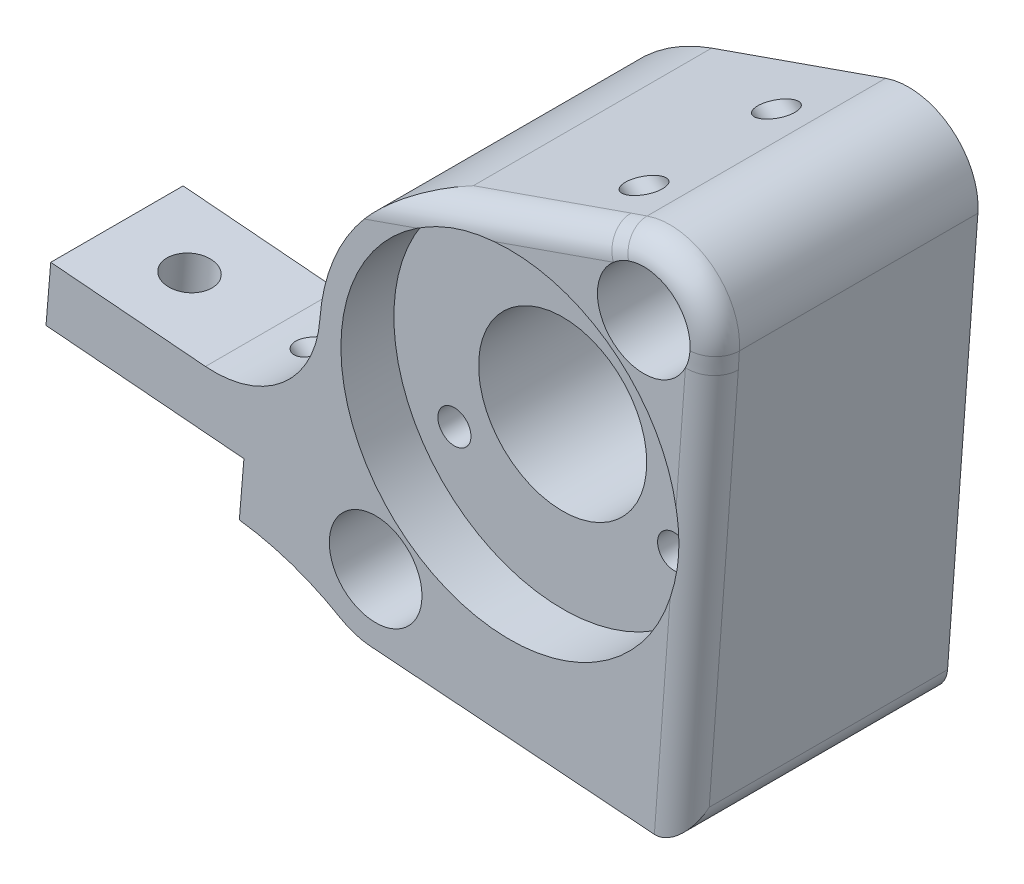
SolidWorks part; units mm, degrees
ref_plane "Front Plane" through (0, 0, 0) normal (0, 0, 1) x (1, 0, 0)
ref_plane "Top Plane" through (0, 0, 0) normal (0, 1, 0) x (1, 0, 0)
ref_plane "Right Plane" through (0, 0, 0) normal (1, 0, 0) x (0, 0, -1)
imported_body "Imported3"
sketch "Sketch1" plane through (0, 0, 18.867) normal (0, 0, 1) x (1, 0, 0)
  line L0 (-13.4246, -10.6666) -> (-13.0674, -6.3583)
  line L1 (-4.428, 1.0246) -> (-3.7297, 10.4722)
  line L2 (-3.7297, 10.4722) -> (18.3046, 18.1781)
  line L3 (25.2734, 12.8354) -> (22.8345, -20.1608)
  line L4 (22.8345, -20.1608) -> (-10.7231, -17.6803)
  line L5 (-10.7231, -17.6803) -> (-10.1639, -10.937)
  line L6 (-10.1639, -10.937) -> (-13.4246, -10.6666)
  arc A0 (-13.0674, -6.3583) -> (-4.428, 1.0246) centre (-12.4063, 1.6143) ccw
  arc A1 (18.3046, 18.1781) -> (25.2734, 12.8354) centre (20.0377, 13.2224) cw
extrude "Boss-Extrude1" add sketch "Sketch1" along normal blind 1.133
sketch "Sketch2" plane through (-12.4545, 1.0328, 0) normal (-0.9966, 0.0826, 0) x (0, 0, 1)
  line L0 (10, -11.6827) -> (10, -7.4165)
  line L1 (10, -7.4165) -> (20, -7.4165)
  line L2 (20, -7.4165) -> (20, -11.7395)
  line L3 (20, -11.7395) -> (18.867, -11.7395)
  line L4 (18.867, -11.7395) -> (18.2791, -10.4597)
  line L5 (18.2791, -10.4597) -> (16.8262, -10.4515)
  line L6 (16.8262, -10.4515) -> (16.3354, -11.4887)
  line L7 (15.9444, -11.7165) -> (13.7842, -11.7042)
  line L8 (13.7842, -11.7042) -> (13.1992, -10.4308)
  line L9 (13.1992, -10.4308) -> (11.7463, -10.4226)
  line L10 (11.7463, -10.4226) -> (11.2555, -11.4598)
  line L11 (10.8645, -11.6876) -> (10, -11.6827)
  arc A0 (16.3354, -11.4887) -> (15.9444, -11.7165) centre (15.9862, -11.3388) cw
  arc A1 (11.2555, -11.4598) -> (10.8645, -11.6876) centre (10.9063, -11.3099) cw
extrude "Boss-Extrude2" add sketch "Sketch2" along normal blind 11.728
sketch "Sketch3" plane through (0, 0, 10) normal (0, 0, -1) x (-1, 0, 0)
  line L0 (9.7488, -5.9314) -> (10.7231, -17.6803)
  line L1 (10.7231, -17.6803) -> (-22.8345, -20.1608)
  line L2 (-22.8345, -20.1608) -> (-25.2734, 12.8354)
  line L3 (-18.3046, 18.1781) -> (3.7297, 10.4722)
  line L4 (3.7297, 10.4722) -> (4.428, 1.0246)
  arc A0 (4.428, 1.0246) -> (9.7488, -5.9314) centre (12.4063, 1.6143) ccw
  arc A1 (-25.2734, 12.8354) -> (-18.3046, 18.1781) centre (-20.0377, 13.2224) cw
extrude "Boss-Extrude3" add sketch "Sketch3" along normal blind 10
sketch "Sketch4" plane through (0, 0, 0) normal (0, 0, -1) x (-1, 0, 0)
  line L0 (1.8992, -18.3326) -> (10.7231, -17.6803)
  line L1 (10.7231, -17.6803) -> (10.5106, -15.1178)
  arc A0 (10.5106, -15.1178) -> (1.8992, -18.3326) centre (13.0125, -34.9607) ccw
extrude "Cut-Extrude1" cut sketch "Sketch4" against normal through all
draft "Draft1" type of draft neutral plane draft angle 0.326 faces to draft 1 parameters "D1"=0.326
ref_plane "Plane1" through (3.6422, -2.7923, 0) normal (0.7936, -0.6084, 0) x (0, 0, -1)
hole_wizard "#2 Clearance Hole1" positions "Sketch6" profile "Sketch5" hole size "#2" standard "ANSI Inch"
sketch "Sketch6" plane through (3.6422, -2.7923, 0) normal (0.7936, -0.6084, 0) x (0, 0, -1)
  point P0 (-5, -10.6051)
sketch "Sketch5" plane through (-2.8102, -11.2086, 5) normal (0, 0, 1) x (0.6084, 0.7936, 0)
  line L0 (0, 0) -> (0, 35.7581)
  line L1 (0, 35.7581) -> (1.25, 35.7581)
  line L2 (1.25, 35.7581) -> (1.25, 0)
  line L5 (1.25, 0) -> (0, 0)
  line L11 (0, -6.35) -> (0, 107.95) construction
  dimension "Thru Hole Dia." = 2.5
  dimension "Thru Hole Depth" = 35.7581
ref_plane "Plane2" through (-4.0498, 3.1048, 0) normal (-0.7936, 0.6084, 0) x (0, 0, 1)
hole_wizard "#2 Clearance Hole2" positions "Sketch8" profile "Sketch7" hole size "#2" standard "ANSI Inch"
sketch "Sketch8" plane through (-4.0498, 3.1048, 0) normal (-0.7936, 0.6084, 0) x (0, 0, 1)
  point P0 (15, -10.6051)
sketch "Sketch7" plane through (-10.5022, -5.3115, 15) normal (0, 0, 1) x (-0.6084, -0.7936, 0)
  line L0 (0, 0) -> (0, 22.5281)
  line L1 (0, 22.5281) -> (1.25, 22.5281)
  line L2 (1.25, 22.5281) -> (1.25, 0)
  line L5 (1.25, 0) -> (0, 0)
  line L11 (0, -6.35) -> (0, 107.95) construction
  dimension "Thru Hole Dia." = 2.5
  dimension "Thru Hole Depth" = 22.5281
hole_wizard "1/4 Clearance Hole1" positions "Sketch10" profile "Sketch9" hole size "1/4" standard "ANSI Inch"
sketch "Sketch10" plane through (0, 0, 20) normal (0, 0, 1) x (1, 0, 0)
  point P0 (20.0377, 13.2224)
  point P1 (-0.2147, -13.1942)
sketch "Sketch9" plane through (20.0377, 13.2224, 20) normal (1, 0, 0) x (0, -1, 0)
  line L0 (0, 0) -> (0, 20)
  line L1 (0, 20) -> (3.5, 20)
  line L2 (3.5, 20) -> (3.5, 0)
  line L5 (3.5, 0) -> (0, 0)
  line L11 (0, -6.35) -> (0, 107.95) construction
  dimension "Thru Hole Dia." = 7
  dimension "Thru Hole Depth" = 20
ref_plane "Plane3" through (0.6033, -0.4625, 0) normal (-0.7936, 0.6084, 0) x (0, 0, 1)
hole_wizard "#2 Clearance Hole3" positions "Sketch12" profile "Sketch11" hole size "#2" standard "ANSI Inch"
sketch "Sketch12" plane through (0.6033, -0.4625, 0) normal (-0.7936, 0.6084, 0) x (0, 0, 1)
  point P0 (15, 22.6849)
  point P1 (5, 22.6849)
sketch "Sketch11" plane through (14.4054, 17.5405, 15) normal (0, 0, 1) x (-0.6084, -0.7936, 0)
  line L0 (0, 0) -> (0, 3.5971)
  line L1 (0, 3.5971) -> (1.25, 3.5971)
  line L2 (1.25, 3.5971) -> (1.25, 0)
  line L5 (1.25, 0) -> (0, 0)
  line L11 (0, -6.35) -> (0, 107.95) construction
  dimension "Thru Hole Dia." = 2.5
  dimension "Thru Hole Depth" = 3.5971
hole_wizard "Hole1" positions "Sketch14" profile "Sketch13" legacy
sketch "Sketch14" plane through (0, 0, 20) normal (0, 0, 1) x (1, 0, 0)
  point P0 (9.9115, 0.0141)
sketch "Sketch13" plane through (9.9115, 0.0141, 20) normal (1, 0, 0) x (0, -1, 0)
  line L0 (0, 0) -> (0, 20)
  line L1 (0, 20) -> (6.35, 20)
  line L2 (6.35, 20) -> (6.35, 4)
  line L3 (6.35, 4) -> (12.75, 4)
  line L4 (12.75, 4) -> (12.75, 0)
  line L5 (12.75, 0) -> (0, 0)
  line L6 (0, 110) -> (0, -10) construction
  dimension "Diameter" = 12.7
  dimension "Depth" = 20
  dimension "C-Bore Diameter" = 25.5
  dimension "C-Bore Depth" = 4
hole_wizard "#2 Clearance Hole4" positions "Sketch16" profile "Sketch15" hole size "#2" standard "ANSI Inch"
sketch "Sketch16" plane through (0, 0, 16) normal (0, 0, 1) x (1, 0, 0)
  point P0 (1.7354, -4.9027)
  point P1 (18.3305, -4.7625)
  point P2 (9.9115, 9.5391)
sketch "Sketch15" plane through (1.7354, -4.9027, 16) normal (1, 0, 0) x (0, -1, 0)
  line L0 (0, 0) -> (0, 16)
  line L1 (0, 16) -> (1.25, 16)
  line L2 (1.25, 16) -> (1.25, 0)
  line L5 (1.25, 0) -> (0, 0)
  line L11 (0, -6.35) -> (0, 107.95) construction
  dimension "Thru Hole Dia." = 2.5
  dimension "Thru Hole Depth" = 16
hole_wizard "#4 Clearance Hole1" positions "Sketch18" profile "Sketch17" hole size "#4" standard "ANSI Inch"
sketch "Sketch18" plane through (-0.6129, -7.3911, 0) normal (0.0826, 0.9966, 0) x (0.9966, -0.0826, 0)
  point P0 (-18.7253, -15)
sketch "Sketch17" plane through (-19.2741, -5.8436, 15) normal (0, 0, 1) x (-0.9966, 0.0826, 0)
  line L0 (0, 0) -> (0, 14.7507)
  line L1 (0, 14.7507) -> (1.7, 14.7507)
  line L2 (1.7, 14.7507) -> (1.7, 0)
  line L5 (1.7, 0) -> (0, 0)
  line L11 (0, -6.35) -> (0, 107.95) construction
  dimension "Thru Hole Dia." = 3.4
  dimension "Thru Hole Depth" = 14.7507
fillet "Fillet1" radius 0.38 9 edges at (-14.3027, -10.5583, 13.7842) (-17.6377, -10.3107, 18.8641) (-17.5301, -9.0129, 13.1992) (-17.5318, -9.0335, 16.8262) (-17.5325, -9.0417, 18.2791) (-17.5294, -9.0047, 11.7463) (-22.9611, -9.8403, 13.7842) (-19.5414, -9.0664, 13.3) (-17.9439, -10.2623, 14.8236)
fillet "Fillet2" radius 2 4 edges at (22.8345, -20.1608, 10) (24.054, -3.6627, 20) (23.2319, 17.3889, 20) (7.2874, 14.3251, 20)
fillet "Fillet3" radius 5.25 1 edges at (-1.8992, -18.3326, 10)
fillet "Fillet4" radius 14.375 2 edges at (-3.7297, 10.4722, 9) (-3.7768, 9.8351, 19.4142)
